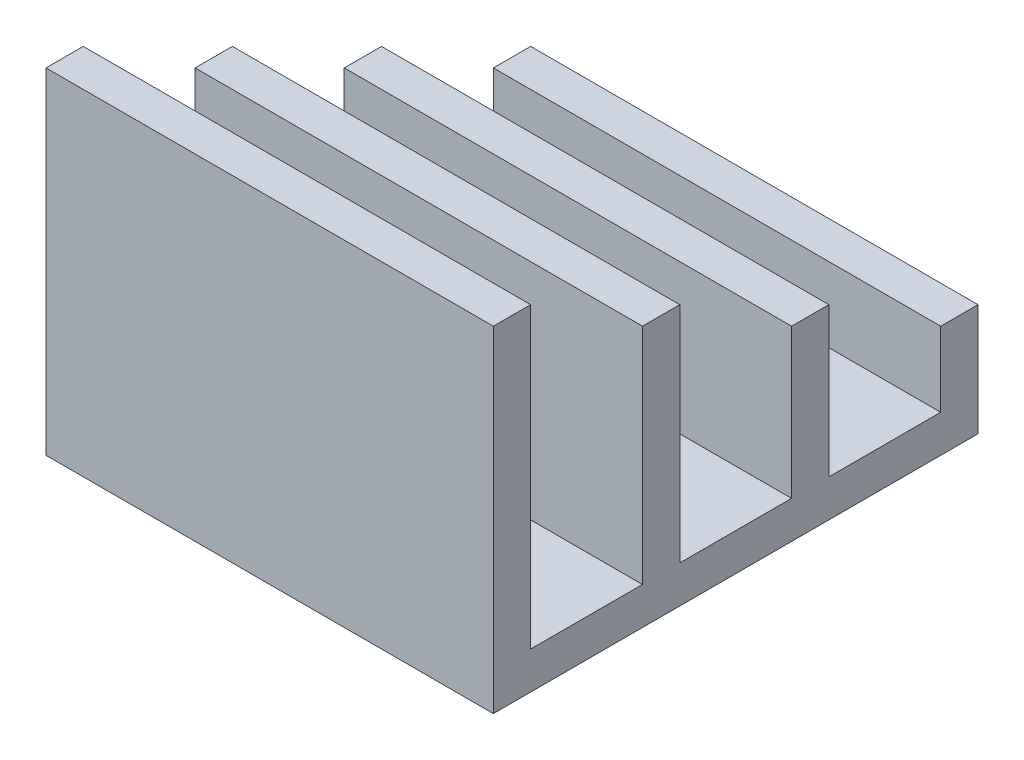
SolidWorks part; units mm, degrees
ref_plane "Front Plane" through (0, 0, 0) normal (0, 0, 1) x (1, 0, 0)
ref_plane "Top Plane" through (0, 0, 0) normal (0, 1, 0) x (1, 0, 0)
ref_plane "Right Plane" through (0, 0, 0) normal (1, 0, 0) x (0, 0, -1)
sketch "Sketch1" plane through (0, 0, 0) normal (1, 0, 0) x (0, 0, -1)
  line L0 (0, 0) -> (0, 114.3)
  line L1 (0, 114.3) -> (12.7, 114.3)
  line L2 (12.7, 114.3) -> (12.7, 12.7)
  line L3 (12.7, 12.7) -> (50.8, 12.7)
  line L4 (50.8, 12.7) -> (50.8, 88.9)
  line L5 (50.8, 88.9) -> (63.5, 88.9)
  line L6 (63.5, 88.9) -> (63.5, 12.7)
  line L7 (63.5, 12.7) -> (101.6, 12.7)
  line L8 (101.6, 12.7) -> (101.6, 63.5)
  line L9 (101.6, 63.5) -> (114.3, 63.5)
  line L10 (114.3, 63.5) -> (114.3, 12.7)
  line L11 (114.3, 12.7) -> (152.4, 12.7)
  line L12 (152.4, 12.7) -> (152.4, 38.1)
  line L13 (152.4, 38.1) -> (165.1, 38.1)
  line L14 (165.1, 38.1) -> (165.1, 0)
  line L15 (165.1, 0) -> (0, 0)
  line L16 (12.7, 12.7) -> (12.7, 0) construction
  dimension "D1" = 12.7
  dimension "D2" = 38.1
  dimension "D3" = 114.3
  dimension "D4" = 88.9
  dimension "D5" = 63.5
  dimension "D6" = 38.1
extrude "Boss-Extrude1" add sketch "Sketch1" along normal blind 152.4
sketch "Sketch2" plane through (0, 0, -63.5) normal (0, 0, -1) x (-1, 0, 0)
  line L0 (-50.8, 31.75) -> (-50.8, 12.7)
  line L1 (-152.4, 12.7) -> (0, 12.7) construction
  line L2 (-50.8, 12.7) -> (-101.6, 12.7)
  line L3 (-101.6, 12.7) -> (-101.6, 31.75)
  line L4 (-152.4, 0) -> (0, 0) construction
  arc A0 (-50.8, 31.75) -> (-101.6, 31.75) centre (-76.2, 31.75) ccw
  point P10 (-76.2, 0)
  dimension "D2" = 25.4
  dimension "D1" = 19.05
